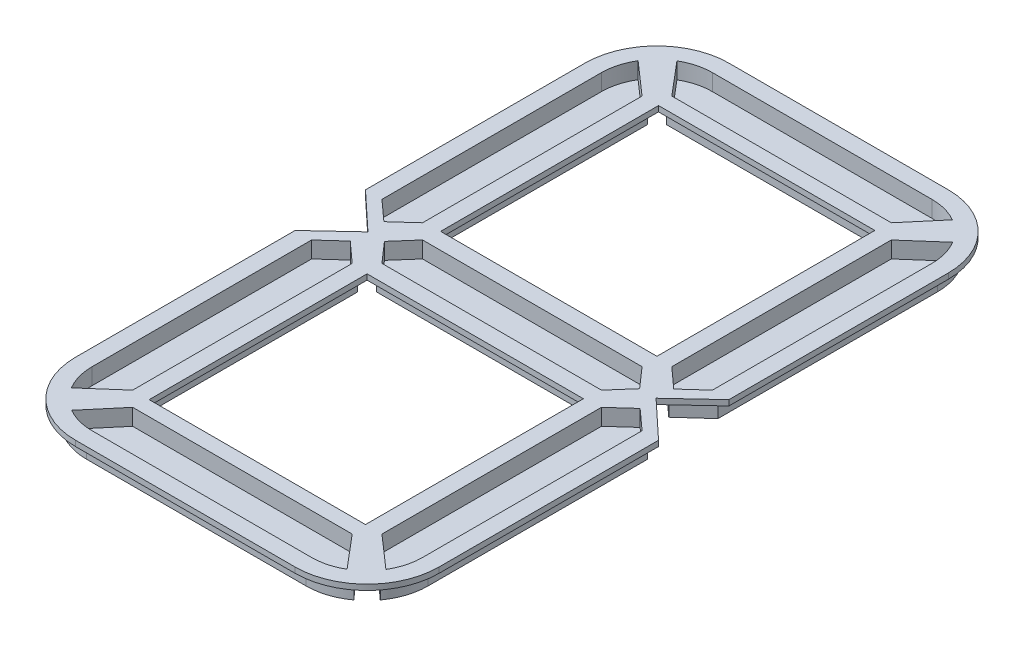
SolidWorks part; units mm, degrees
ref_plane "Alzado" through (0, 0, 0) normal (0, 0, 1) x (1, 0, 0)
ref_plane "Planta" through (0, 0, 0) normal (0, 1, 0) x (1, 0, 0)
ref_plane "Vista lateral" through (0, 0, 0) normal (1, 0, 0) x (0, 0, -1)
sketch "Croquis1" plane through (0, 0, 0) normal (0, 1, 0) x (1, 0, 0)
  line L0 (0, 4.7) -> (-20, 4.7) construction
  line L1 (20, -4.7) -> (-20, -4.7)
  line L3 (20, 4.7) -> (-20, 4.7)
  line L5 (20.6338, -3.9991) -> (-20.6338, 3.9991) construction
  line L6 (20.6338, 3.9991) -> (-20.6338, -3.9991) construction
  line L7 (-20, 4.7) -> (20, 4.7) construction
  line L8 (-20, 4.7) -> (-24.25, 0)
  line L9 (-24.25, 0) -> (-20, -4.7)
  line L10 (20, 4.7) -> (24.25, 0)
  line L11 (24.25, 0) -> (20, -4.7)
  point P0 (0, 0)
extrude "Saliente-Extruir1" add sketch "Croquis1" along normal blind 4
sketch "Croquis2" plane through (0, 4, 0) normal (0, 1, 0) x (1, 0, 0)
  line L0 (-20, 4.7) -> (-20, 6.7) construction
  line L1 (20, 4.7) -> (20, 6.7) construction
  line L2 (20, -4.7) -> (20, -6.7) construction
  line L3 (-20, -4.7) -> (-20, -6.7) construction
  line L4 (-24.25, 0) -> (-26.25, 0) construction
  line L5 (24.25, 0) -> (26.25, 0) construction
  line L6 (-20, 6.7) -> (20, 6.7)
  line L7 (20, 6.7) -> (26.25, 0)
  line L8 (26.25, 0) -> (20, -6.7)
  line L9 (20, -6.7) -> (-20, -6.7)
  line L10 (-20, -6.7) -> (-26.25, 0)
  line L11 (-26.25, 0) -> (-20, 6.7)
extrude "Saliente-Extruir2" add sketch "Croquis2" against normal blind 1
sketch "Croquis3" plane through (0, 0, 0) normal (0, -1, 0) x (-1, 0, 0)
  line L0 (20, -4.7) -> (20, -3.7) construction
  line L1 (20, 4.7) -> (20, 3.7) construction
  line L2 (24.25, 0) -> (23.25, 0) construction
  line L3 (-20, -4.7) -> (-20, -3.7) construction
  line L4 (-20, 4.7) -> (-20, 3.7) construction
  line L5 (-24.25, 0) -> (-23.25, 0) construction
  line L6 (23.25, 0) -> (20, -3.7)
  line L7 (20, -3.7) -> (-20, -3.7)
  line L8 (-20, -3.7) -> (-23.25, 0)
  line L9 (-23.25, 0) -> (-20, 3.7)
  line L10 (-20, 3.7) -> (20, 3.7)
  line L11 (20, 3.7) -> (23.25, 0)
extrude "Cortar-Extruir2" cut sketch "Croquis3" against normal blind 4
sketch "Croquis4" plane through (0, 0, 0) normal (0, -1, 0) x (-1, 0, 0)
  line L0 (23.25, 0) -> (20, -3.7)
  line L1 (20, -3.7) -> (-20, -3.7)
  line L2 (-20, -3.7) -> (-23.25, 0)
  line L3 (-23.25, 0) -> (-20, 3.7)
  line L4 (-20, 3.7) -> (-23.25, 0) construction
  line L5 (-20, 3.7) -> (20, 3.7)
  line L6 (20, 3.7) -> (23.25, 0)
extrude "Saliente-Extruir4" add sketch "Croquis4" against normal blind 1
sketch "Croquis5" plane through (0, 3, 0) normal (0, -1, 0) x (-1, 0, 0)
  line L1 (0, 0) -> (0, -26.41) construction
  line L2 (0, -26.41) -> (-26.41, -26.41) construction
  line L3 (0, -26.41) -> (26.41, -26.41) construction
  line L4 (21.71, 28.535) -> (21.71, 46.41) construction
  line L6 (-31.11, -6.41) -> (-31.11, -46.41)
  line L8 (-21.71, -6.41) -> (-21.71, -46.41)
  line L9 (-30.4091, -5.7762) -> (-22.4109, -47.0438) construction
  line L10 (-30.7952, -49.0359) -> (-22.4109, -5.7762) construction
  line L11 (-21.71, -28.535) -> (-21.71, -6.41) construction
  line L14 (20, -48.12) -> (-20, -48.12)
  line L16 (-20, -57.52) -> (20, -57.52)
  line L17 (-21.71, -6.41) -> (-26.41, -2.16)
  line L18 (-26.41, -2.16) -> (-31.11, -6.41)
  line L19 (-21.71, -28.535) -> (-21.71, -46.41) construction
  line L20 (-21.71, -46.41) -> (-26.41, -50.66)
  line L21 (21.71, -6.41) -> (26.41, -2.16)
  line L22 (0, -57.52) -> (-20, -57.52) construction
  line L24 (-24.25, -52.82) -> (-20, -48.12)
  line L25 (-24.25, -52.82) -> (-20, -48.12) construction
  line L28 (-26.5611, -55.3758) -> (-24.25, -52.82)
  line L30 (-28.9658, -52.9711) -> (-26.41, -50.66)
  line L31 (26.41, -2.16) -> (31.11, -6.41)
  line L32 (21.71, -6.41) -> (21.71, -46.41)
  line L33 (31.11, -6.41) -> (31.11, -46.41)
  line L34 (24.25, -52.82) -> (20, -48.12) construction
  line L35 (21.71, -28.535) -> (21.71, -46.41) construction
  line L36 (28.9658, -52.9711) -> (26.41, -50.66)
  line L37 (26.5611, -55.3758) -> (24.25, -52.82)
  line L38 (24.25, -52.82) -> (20, -48.12)
  line L39 (21.71, -46.41) -> (26.41, -50.66)
  line L40 (24.25, 52.82) -> (20, 48.12) construction
  line L41 (-24.25, 52.82) -> (-20, 48.12) construction
  line L42 (0, 57.52) -> (-20, 57.52) construction
  line L43 (-21.71, 28.535) -> (-21.71, 46.41) construction
  line L44 (-21.71, 28.535) -> (-21.71, 6.41) construction
  line L45 (-30.7952, 49.0359) -> (-22.4109, 5.7762) construction
  line L46 (-30.4091, 5.7762) -> (-22.4109, 47.0438) construction
  line L47 (0, 26.41) -> (26.41, 26.41) construction
  line L48 (0, 26.41) -> (-26.41, 26.41) construction
  line L49 (21.71, 46.41) -> (26.41, 50.66)
  line L50 (24.25, 52.82) -> (20, 48.12)
  line L51 (26.5611, 55.3758) -> (24.25, 52.82)
  line L52 (28.9658, 52.9711) -> (26.41, 50.66)
  line L53 (31.11, 6.41) -> (31.11, 46.41)
  line L54 (21.71, 6.41) -> (21.71, 46.41)
  line L55 (26.41, 2.16) -> (31.11, 6.41)
  line L56 (-28.9658, 52.9711) -> (-26.41, 50.66)
  line L57 (-26.5611, 55.3758) -> (-24.25, 52.82)
  line L58 (-24.25, 52.82) -> (-20, 48.12)
  line L59 (21.71, 6.41) -> (26.41, 2.16)
  line L60 (-21.71, 46.41) -> (-26.41, 50.66)
  line L61 (-26.41, 2.16) -> (-31.11, 6.41)
  line L62 (-21.71, 6.41) -> (-26.41, 2.16)
  line L63 (-20, 57.52) -> (20, 57.52)
  line L64 (20, 48.12) -> (-20, 48.12)
  line L65 (-21.71, 6.41) -> (-21.71, 46.41)
  line L66 (-31.11, 6.41) -> (-31.11, 46.41)
  arc A0 (-20, -57.52) -> (-26.5611, -55.3758) centre (-20, -46.41) cw
  arc A1 (-28.9658, -52.9711) -> (-31.11, -46.41) centre (-20, -46.41) cw
  arc A2 (28.9658, -52.9711) -> (31.11, -46.41) centre (20, -46.41) ccw
  arc A3 (20, -57.52) -> (26.5611, -55.3758) centre (20, -46.41) ccw
  arc A4 (20, 57.52) -> (26.5611, 55.3758) centre (20, 46.41) cw
  arc A5 (28.9658, 52.9711) -> (31.11, 46.41) centre (20, 46.41) cw
  arc A6 (-28.9658, 52.9711) -> (-31.11, 46.41) centre (-20, 46.41) ccw
  arc A7 (-20, 57.52) -> (-26.5611, 55.3758) centre (-20, 46.41) ccw
extrude "Saliente-Extruir6" add sketch "Croquis5" along normal blind 3 separate body
sketch "Croquis7" plane through (0, 3, 0) normal (0, 1, 0) x (1, 0, 0)
  line L0 (0, 3.7) -> (0, 0) construction
  line L1 (30.11, 45.41) -> (30.11, 46.41)
  line L2 (28.6563, 51.6331) -> (22.71, 46.41)
  line L3 (-30.11, 7.41) -> (-30.11, 6.41)
  line L4 (22.71, 45.41) -> (22.71, 46.41)
  line L5 (19, 49.12) -> (20, 49.12)
  line L6 (-30.11, 6.41) -> (-26.41, 3.0643)
  line L10 (-20, 3.7) -> (20, 3.7) construction
  line L11 (-26.41, 3.0643) -> (-22.71, 6.41)
  line L12 (-22.71, 6.41) -> (-22.71, 7.41)
  line L15 (30.11, 7.41) -> (30.11, 45.41)
  line L17 (22.71, 7.41) -> (22.71, 45.41)
  line L18 (30.11, 7.41) -> (22.71, 45.41) construction
  line L19 (30.11, 45.41) -> (22.71, 7.41) construction
  line L20 (19, 49.12) -> (-19, 49.12)
  line L22 (19, 56.52) -> (-19, 56.52)
  line L24 (19, 49.12) -> (0, 52.82) construction
  line L25 (19, 56.52) -> (0, 52.82) construction
  line L26 (19, 56.52) -> (20, 56.52)
  line L27 (25.0892, 55.1457) -> (20, 49.12)
  line L28 (-30.11, -7.41) -> (-22.71, -45.41) construction
  line L29 (22.71, 6.41) -> (22.71, 7.41)
  line L30 (-19, 56.52) -> (0, 52.82) construction
  line L31 (26.41, 3.0643) -> (22.71, 6.41)
  line L32 (30.11, 45.41) -> (30.11, 46.41)
  line L33 (19, 56.52) -> (20, 56.52)
  line L34 (-19, 49.12) -> (0, 52.82) construction
  line L35 (-30.11, 45.41) -> (-22.71, 7.41) construction
  line L36 (-30.11, 7.41) -> (-22.71, 45.41) construction
  line L37 (-19, 56.52) -> (-20, 56.52)
  line L38 (-30.11, 45.41) -> (-30.11, 46.41)
  line L39 (-25.0892, 55.1457) -> (-20, 49.12)
  line L40 (-19, 56.52) -> (-20, 56.52)
  line L41 (-22.71, 7.41) -> (-22.71, 45.41)
  line L42 (-30.11, 7.41) -> (-30.11, 45.41)
  line L43 (30.11, 6.41) -> (26.41, 3.0643)
  line L44 (-19, 49.12) -> (-20, 49.12)
  line L45 (-22.71, 45.41) -> (-22.71, 46.41)
  line L46 (-28.6563, 51.6331) -> (-22.71, 46.41)
  line L47 (-30.11, 45.41) -> (-30.11, 46.41)
  line L48 (30.11, 7.41) -> (30.11, 6.41)
  line L49 (-30.11, -45.41) -> (-22.71, -7.41) construction
  line L50 (-19, -49.12) -> (0, -52.82) construction
  line L51 (-19, -56.52) -> (0, -52.82) construction
  line L52 (19, -56.52) -> (0, -52.82) construction
  line L53 (19, -49.12) -> (0, -52.82) construction
  line L54 (30.11, -45.41) -> (22.71, -7.41) construction
  line L55 (30.11, -7.41) -> (22.71, -45.41) construction
  line L57 (30.11, -7.41) -> (30.11, -6.41)
  line L58 (-30.11, -45.41) -> (-30.11, -46.41)
  line L59 (-28.6563, -51.6331) -> (-22.71, -46.41)
  line L60 (-22.71, -45.41) -> (-22.71, -46.41)
  line L61 (-19, -49.12) -> (-20, -49.12)
  line L62 (30.11, -6.41) -> (26.41, -3.0643)
  line L63 (-30.11, -7.41) -> (-30.11, -45.41)
  line L64 (-22.71, -7.41) -> (-22.71, -45.41)
  line L65 (-19, -56.52) -> (-20, -56.52)
  line L66 (-25.0892, -55.1457) -> (-20, -49.12)
  line L67 (-30.11, -45.41) -> (-30.11, -46.41)
  line L68 (-19, -56.52) -> (-20, -56.52)
  line L69 (19, -56.52) -> (20, -56.52)
  line L70 (30.11, -45.41) -> (30.11, -46.41)
  line L71 (26.41, -3.0643) -> (22.71, -6.41)
  line L72 (22.71, -6.41) -> (22.71, -7.41)
  line L73 (25.0892, -55.1457) -> (20, -49.12)
  line L74 (19, -56.52) -> (20, -56.52)
  line L75 (19, -56.52) -> (-19, -56.52)
  line L76 (19, -49.12) -> (-19, -49.12)
  line L77 (22.71, -7.41) -> (22.71, -45.41)
  line L78 (30.11, -7.41) -> (30.11, -45.41)
  line L79 (-22.71, -6.41) -> (-22.71, -7.41)
  line L80 (-26.41, -3.0643) -> (-22.71, -6.41)
  line L81 (-30.11, -6.41) -> (-26.41, -3.0643)
  line L82 (19, -49.12) -> (20, -49.12)
  line L83 (22.71, -45.41) -> (22.71, -46.41)
  line L84 (-30.11, -7.41) -> (-30.11, -6.41)
  line L85 (28.6563, -51.6331) -> (22.71, -46.41)
  line L86 (30.11, -45.41) -> (30.11, -46.41)
  arc A0 (20, 56.52) -> (25.0892, 55.1457) centre (20, 46.41) cw
  arc A1 (28.6563, 51.6331) -> (30.11, 46.41) centre (20, 46.41) cw
  arc A2 (-28.6563, 51.6331) -> (-30.11, 46.41) centre (-20, 46.41) ccw
  arc A3 (-20, 56.52) -> (-25.0892, 55.1457) centre (-20, 46.41) ccw
  arc A4 (-20, -56.52) -> (-25.0892, -55.1457) centre (-20, -46.41) cw
  arc A5 (-28.6563, -51.6331) -> (-30.11, -46.41) centre (-20, -46.41) cw
  arc A6 (28.6563, -51.6331) -> (30.11, -46.41) centre (20, -46.41) ccw
  arc A7 (20, -56.52) -> (25.0892, -55.1457) centre (20, -46.41) ccw
  point P18 (26.41, 26.41)
  point P23 (0, 52.82)
  point P40 (0, 56.52)
  point P42 (-26.41, 26.41)
  point P84 (-26.41, -26.41)
  point P85 (0, -56.52)
  point P86 (0, -52.82)
  point P87 (26.41, -26.41)
extrude "Cortar-Extruir3" cut sketch "Croquis7" against normal blind 2 contours L37 A3 L39 L44 L20 L5 L27 A0 L26 L22 | L46 A2 L38 L42 L3 L6 L11 L12 L41 L45 | A1 L2 L4 L17 L29 L31 L43 L48 L15 L1 | L85 A6 L70 L78 L57 L62 L71 L72 L77 L83 | A5 L59 L60 L64 L79 L80 L81 L84 L63 L58 | L69 A7 L73 L82 L76 L61 L66 A4 L65 L75
sketch "Croquis8" plane through (0, 3, 0) normal (0, 1, 0) x (1, 0, 0)
  line L1 (19.71, 6.41) -> (19.71, 46.41)
  line L2 (19.71, 46.41) -> (-19.71, 46.41)
  line L4 (-26.41, 3.0643) -> (-30.11, 6.41)
  line L9 (-22.71, 6.41) -> (-26.41, 3.0643)
  line L10 (-20, 59.52) -> (20, 59.52)
  line L11 (22.71, 6.41) -> (26.41, 3.0643)
  line L12 (33.11, 6.41) -> (33.11, 46.41)
  line L19 (19.71, 6.41) -> (26.25, 0)
  line L20 (26.25, 0) -> (33.11, 6.41)
  line L21 (-30.11, 6.41) -> (-30.11, 46.41)
  line L22 (26.41, 3.0643) -> (30.11, 6.41)
  line L23 (-26.25, 0) -> (-33.11, 6.41)
  line L24 (-19.71, 6.41) -> (-26.25, 0)
  line L28 (-33.11, 6.41) -> (-33.11, 46.41)
  line L31 (-19.71, 6.41) -> (-19.71, 46.41)
  line L32 (-19.71, -6.41) -> (-19.71, -46.41)
  line L35 (-33.11, -6.41) -> (-33.11, -46.41)
  line L39 (-19.71, -6.41) -> (-26.25, 0)
  line L40 (-26.25, 0) -> (-33.11, -6.41)
  line L41 (26.25, 0) -> (33.11, -6.41)
  line L42 (19.71, -6.41) -> (26.25, 0)
  line L47 (33.11, -6.41) -> (33.11, -46.41)
  line L48 (-20, -59.52) -> (20, -59.52)
  line L49 (30.11, 6.41) -> (30.11, 46.41)
  line L53 (22.71, 6.41) -> (22.71, 46.41)
  line L54 (19.71, -46.41) -> (-19.71, -46.41)
  line L55 (19.71, -6.41) -> (19.71, -46.41)
  line L56 (22.71, 6.41) -> (22.71, 46.41) construction
  line L57 (28.6563, 51.6331) -> (22.71, 46.41) construction
  line L58 (20, 49.12) -> (-20, 49.12)
  line L59 (20, 49.12) -> (-20, 49.12) construction
  line L60 (-20, 56.52) -> (20, 56.52)
  line L61 (20, 56.52) -> (-20, 56.52) construction
  line L62 (22.71, 46.41) -> (28.6563, 51.6331)
  line L63 (25.0892, 55.1457) -> (20, 49.12)
  line L64 (-22.71, 6.41) -> (-22.71, 46.41)
  line L68 (-22.71, 46.41) -> (-28.6563, 51.6331)
  line L69 (-25.0892, 55.1457) -> (-20, 49.12)
  line L70 (26.41, -3.0643) -> (30.11, -6.41)
  line L71 (22.71, -6.41) -> (26.41, -3.0643)
  line L72 (30.11, -6.41) -> (30.11, -46.41)
  line L73 (22.71, -6.41) -> (22.71, -46.41)
  line L74 (22.71, -46.41) -> (28.6563, -51.6331)
  line L75 (25.0892, -55.1457) -> (20, -49.12)
  line L76 (20, -49.12) -> (-20, -49.12)
  line L77 (-20, -56.52) -> (20, -56.52)
  line L78 (-25.0892, -55.1457) -> (-20, -49.12)
  line L79 (-30.11, -6.41) -> (-30.11, -46.41)
  line L80 (-26.41, -3.0643) -> (-30.11, -6.41)
  line L81 (-22.71, -6.41) -> (-26.41, -3.0643)
  line L82 (-22.71, -6.41) -> (-22.71, -46.41)
  line L83 (-22.71, -46.41) -> (-28.6563, -51.6331)
  arc A0 (-28.6563, 51.6331) -> (-30.11, 46.41) centre (-20, 46.41) ccw
  arc A2 (20, 59.52) -> (33.11, 46.41) centre (20, 46.41) cw
  arc A3 (-20, 59.52) -> (-33.11, 46.41) centre (-20, 46.41) ccw
  arc A6 (-20, -59.52) -> (-33.11, -46.41) centre (-20, -46.41) cw
  arc A7 (20, -59.52) -> (33.11, -46.41) centre (20, -46.41) ccw
  arc A9 (20, 56.52) -> (25.0892, 55.1457) centre (20, 46.41) cw
  arc A10 (28.6563, 51.6331) -> (30.11, 46.41) centre (20, 46.41) cw
  arc A11 (-20, 56.52) -> (-25.0892, 55.1457) centre (-20, 46.41) ccw
  arc A13 (28.6563, -51.6331) -> (30.11, -46.41) centre (20, -46.41) ccw
  arc A14 (20, -56.52) -> (25.0892, -55.1457) centre (20, -46.41) ccw
  arc A15 (-20, -56.52) -> (-25.0892, -55.1457) centre (-20, -46.41) cw
  arc A16 (-28.6563, -51.6331) -> (-30.11, -46.41) centre (-20, -46.41) cw
  point P0 (25.6831, 49.0215)
  point P28 (0, 49.12)
  point P29 (0, 56.52)
  point P53 (25.6831, -49.0215)
extrude "Saliente-Extruir8" add sketch "Croquis8" along normal blind 1 contours L48 A7 L47 L41 L42 L55 L54 L32 L39 L40 L35 A6 L77 A15 L78 L76 L75 A14 L83 A16 L79 L80 L81 L82 M75 M80 M79 M78 M77 M76 | M80 M75 M76 M77 M78 M79 M86 M81 M82 M83 M84 M85 | L10 A3 L28 L23 L24 L31 L2 L1 L19 L20 L12 A2 A11 L60 A9 L63 L58 L69 A0 L68 L64 L9 L4 L21 L62 A10 L49 L22 L11 L53
